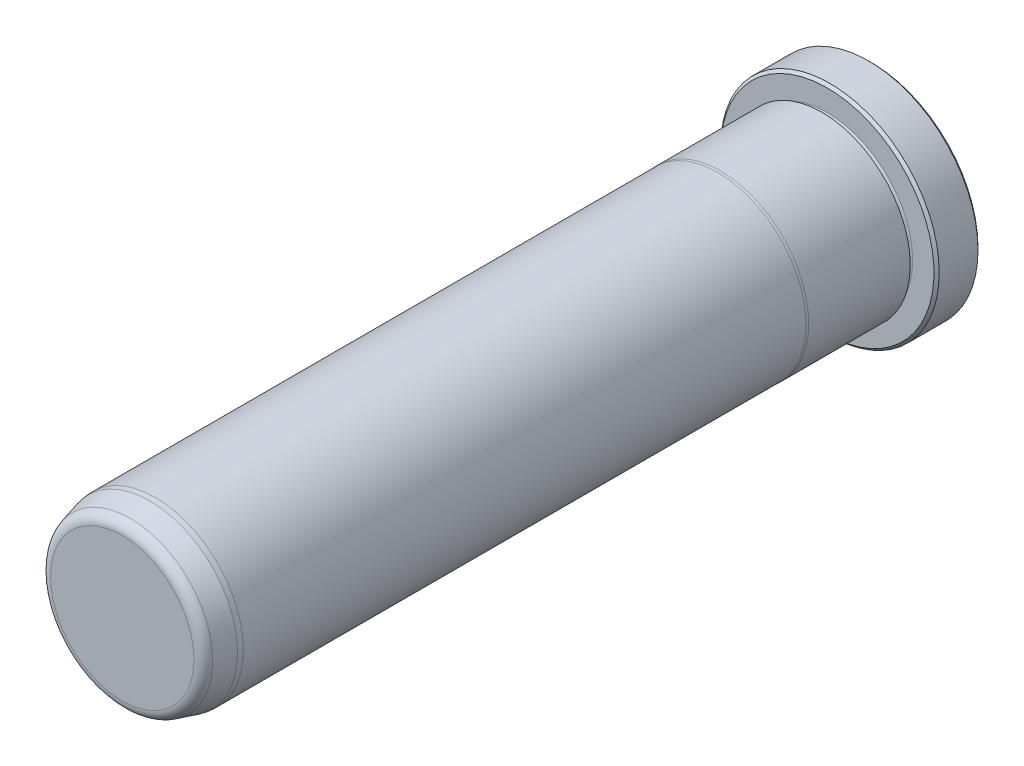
SolidWorks part; units mm, degrees
ref_plane "Front Plane" through (0, 0, 0) normal (0, 0, 1) x (1, 0, 0)
ref_plane "Top Plane" through (0, 0, 0) normal (0, 1, 0) x (1, 0, 0)
ref_plane "Right Plane" through (0, 0, 0) normal (1, 0, 0) x (0, 0, -1)
sketch "Sketch1" plane through (0, 0, 0) normal (1, 0, 0) x (0, 0, -1)
  line L0 (0, 0) -> (0, 15.748)
  line L1 (0, 15.748) -> (-6.35, 15.748)
  line L2 (-6.35, 15.748) -> (-6.35, 12.3063)
  line L3 (-6.35, 11.9253) -> (-7.112, 11.9253) construction
  line L4 (-7.112, 12.3063) -> (-7.112, 12.7127)
  line L5 (-7.112, 12.7127) -> (-21.7348, 12.7127)
  line L6 (-21.7348, 12.7127) -> (-22.098, 12.6873)
  line L7 (-22.098, 12.6873) -> (-103.1875, 12.6873)
  line L9 (-107.95, 11.5487) -> (-107.95, 0)
  line L10 (-107.95, 0) -> (0, 0)
  line L11 (0, 0) -> (13.6287, 0) construction
  line L12 (-103.1875, 12.6873) -> (-103.9495, 12.6206)
  line L13 (-103.9495, 12.6206) -> (-107.95, 11.5487)
  arc A0 (-7.112, 12.3063) -> (-6.35, 12.3063) centre (-6.731, 12.3063) ccw
  dimension "D14" = 0.762
  dimension "D1" = 6.35
  dimension "D2" = 0.762
  dimension "D3" = 31.496
  dimension "D4" = 25.4254
  dimension "D5" = 22.098
  dimension "D6" = 107.95
  dimension "D7" = 0.7874
  dimension "D8" = 4
  dimension "D9" = 25.3746
  dimension "D10" = 5
  dimension "D11" = 15
  dimension "D12" = 0.762
  dimension "D13" = 4.7625
revolve "Revolve1" add sketch "Sketch1" angle 360 about L11
fillet "Fillet6" radius 1.5875 1 edges at (11.5487, 0, 107.95)
chamfer "Chamfer1" distance 0.381 angle 45 2 edges at (15.748, 0, 0) (15.748, 0, 6.35)
